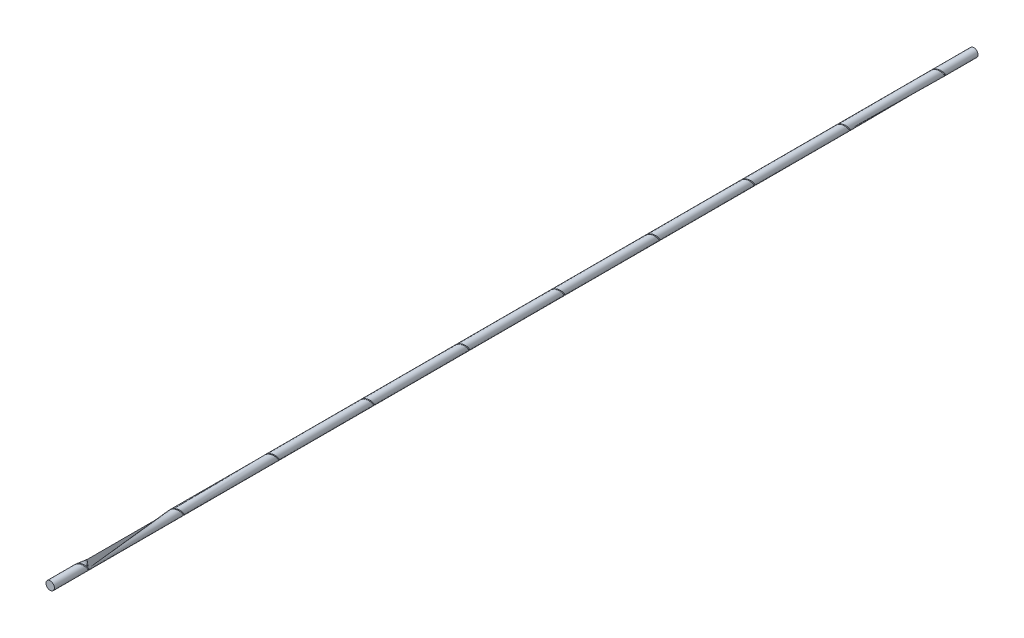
SolidWorks part; units mm, degrees
ref_plane "Front Plane" through (0, 0, 0) normal (0, 0, 1) x (1, 0, 0)
ref_plane "Top Plane" through (0, 0, 0) normal (0, 1, 0) x (1, 0, 0)
ref_plane "Right Plane" through (0, 0, 0) normal (1, 0, 0) x (0, 0, -1)
sketch "Sketch1" plane through (0, 0, 0) normal (0, 0, 1) x (1, 0, 0)
  circle A0 centre (0, 0) radius 25
  dimension "D1" = 50
extrude "Boss-Extrude1" add sketch "Sketch1" along normal blind 5500
ref_plane "Plane1" through (0, 0, 150) normal (0, 0, 1) x (1, 0, 0)
sketch "Sketch2" plane through (0, 0, 150) normal (0, 0, 1) x (1, 0, 0)
  circle A0 centre (0, 0) radius 27.646
  dimension "D1" = 55.292
curve "Helix/Spiral1"
sketch "Sketch3" plane through (0, 0, 0) normal (0, 1, 0) x (1, 0, 0)
  circle A0 centre (-27.646, -150) radius 3.969
  spline S0 degree 3 poles (-27.646, -150) (-27.646, -151.3307) (-27.0608, -154.0012) (-24.4828, -157.9997) (-20.3663, -162.0001) (-14.9702, -166) (-8.6335, -170) (-1.7543, -174) (5.2352, -178) (11.8957, -182) (17.8087, -186) (22.6028, -190) (25.9766, -194) (27.7183, -198) (27.7183, -202) (25.9766, -206) (22.6028, -210) (17.8087, -214) (11.8957, -218) (5.2352, -222) (-1.7543, -226) (-8.6335, -230) (-14.9702, -234) (-20.3663, -237.9999) (-24.4828, -242.0003) (-27.0608, -245.9988) (-27.646, -248.6693) (-27.646, -250) knots 0 0 0 0 0.04 0.08 0.12 0.16 0.2 0.24 0.28 0.32 0.36 0.4 0.44 0.48 0.52 0.56 0.6 0.64 0.68 0.72 0.76 0.8 0.84 0.88 0.92 0.96 1 1 1 1 construction
  dimension "D1" = 7.938
sweep "Cut-Sweep1" cut profiles "Sketch3" path "Helix/Spiral1"
pattern_linear "LPattern1" count 10 spacing 566.6667 along (0, 0, -1) of "Cut-Sweep1"
